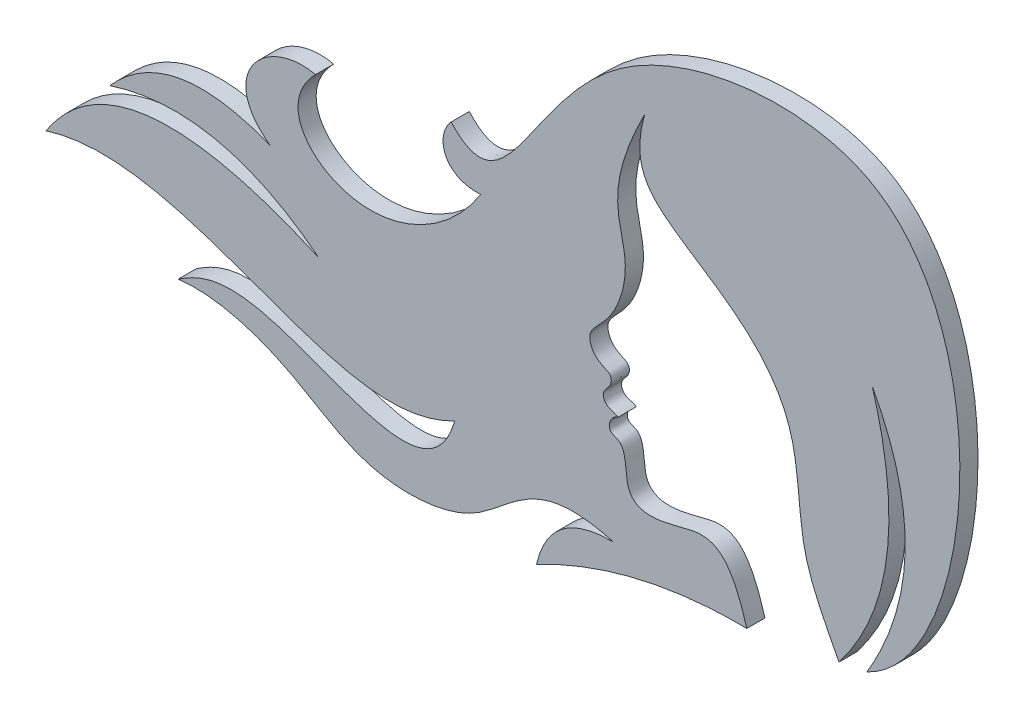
SolidWorks part; units mm, degrees
ref_plane "Front Plane" through (0, 0, 0) normal (0, 0, 1) x (1, 0, 0)
ref_plane "Top Plane" through (0, 0, 0) normal (0, 1, 0) x (1, 0, 0)
ref_plane "Right Plane" through (0, 0, 0) normal (1, 0, 0) x (0, 0, -1)
sketch "Picture" plane through (0, 0, 0) normal (0, 0, 1) x (1, 0, 0)
  line L0 (-354.2886, -45.4411) -> (145.7114, -45.4411) construction
  dimension "D1" = 500
sketch "Sketch2" plane through (0, 0, 0) normal (0, 0, 1) x (1, 0, 0)
  line L0 (96.8816, -76.9583) -> (137.5903, -8.7688) construction
  line L1 (137.5903, -8.7688) -> (99.8352, 60.9264) construction
  line L2 (99.8352, 60.9264) -> (124.9707, -23.8423) construction
  line L3 (124.9707, -23.8423) -> (81.5188, -79.936) construction
  line L4 (30.7604, -89.2686) -> (-31.0567, -88.3468) construction
  line L5 (-31.0567, -88.3468) -> (-85.0738, -116.5689) construction
  line L6 (-320.1333, -5.7193) -> (-260.5321, 13.5315) construction
  line L7 (-260.5321, 13.5315) -> (-204.8855, -30.3888) construction
  line L8 (-204.8855, -30.3888) -> (-314.2112, 18.7263) construction
  line L9 (-314.2112, 18.7263) -> (-355.3095, -44.8919) construction
  line L10 (-355.3095, -44.8919) -> (-281.1116, -21.0649) construction
  line L11 (-281.1116, -21.0649) -> (-207.5549, -89.7678) construction
  line L12 (-162.8538, -87.278) -> (-130.1269, -70.7791) construction
  line L13 (-130.1269, -70.7791) -> (-149.0629, -135.8716) construction
  line L14 (-149.0629, -135.8716) -> (-228.8308, -51.3697) construction
  line L15 (-259.7193, -64.239) -> (-282.5077, -79.2554) construction
  line L16 (-228.8308, -51.3697) -> (-259.7193, -64.239) construction
  line L17 (-207.5549, -89.7678) -> (-162.8538, -87.278) construction
  line L20 (-42.6455, -84.7637) -> (-77.616, -84.5109) construction
  line L21 (-77.616, -84.5109) -> (-85.0738, -116.5689) construction
  spline S0 degree 3 poles (96.8816, -76.9583) (151.2499, -51.4561) (169.9493, 100.0005) (76.3463, 179.4746) (-80.7116, 161.4531) (-100.7165, 37.137) (-132.1486, 70.8985) knots 0 0 0 0 0.421722 0.472248 0.700633 1 1 1 1
  spline S1 degree 3 poles (-132.1486, 70.8985) (-141.7006, 60.3257) (-135.7511, 42.9582) (-115.7913, 44.5519) knots 0 0 0 0 1 1 1 1
  spline S2 degree 3 poles (-115.7913, 44.5519) (-135.4395, 13.6686) (-193.3562, -8.7409) (-227.7464, 34.9026) (-206.8201, 56.1613) knots 0 0 0 0 0.521454 1 1 1 1
  spline S3 degree 3 poles (-206.8201, 56.1613) (-234.2464, 62.3302) (-262.8138, 32.2946) (-231.6716, 9.8032) knots 0 0 0 0 1 1 1 1
  spline S4 degree 2 poles (-231.6716, 9.8032) (-286.8531, 31.9452) (-320.1333, -5.7193) knots 0 0 0 1 1 1
  spline S5 degree 3 poles (-25.5912, 127.69) (-50.6896, 78.3833) (-29.051, 64.9818) (-41.061, 22.3908) (-56.7557, 9.6298) (-53.6486, -4.2986) (-44.0456, -3.2543) (-43.6916, -11.9856) (-49.3117, -14.8486) (-46.8278, -22.8113) (-43.259, -22.1214) (-40.0407, -23.8379) knots 0 0 0 0 0.134508 0.202578 0.22841 0.238908 0.299932 0.313731 0.363096 0.376392 0.440521 0.440521 0.440521 0.440521
  spline S6 degree 3 poles (-40.0407, -23.8379) (-44.0761, -25.0412) (-46.9785, -33.3839) (-34.8514, -34.6017) (-38.4069, -65.1344) (-1.9862, -60.3796) (19.4297, -49.6693) (30.7604, -89.2686) knots 0 0 0 0 0.068246 0.122923 0.276509 0.562112 1 1 1 1
  spline S7 degree 2 poles (96.8816, -76.9583) (137.5903, -8.7688) (99.8352, 60.9264) knots 0 0 0 1 1 1
  spline S8 degree 2 poles (99.8352, 60.9264) (124.9707, -23.8423) (81.5188, -79.936) knots 0 0 0 1 1 1
  spline S9 degree 2 poles (30.7604, -89.2686) (-31.0567, -88.3468) (-85.0738, -116.5689) knots 0 0 0 1 1 1
  spline S10 degree 2 poles (-320.1333, -5.7193) (-260.5321, 13.5315) (-204.8855, -30.3888) knots 0 0 0 1 1 1
  spline S11 degree 2 poles (-204.8855, -30.3888) (-314.2112, 18.7263) (-355.3095, -44.8919) knots 0 0 0 1 1 1
  spline S12 degree 3 poles (81.5188, -79.936) (70.1066, -58.0197) (59.5159, -37.7395) (58.7174, 45.5659) (-11.0596, 75.3073) (-32.6041, 102.8069) (-25.5912, 127.69) knots 0 0 0 0 0.197258 0.35261 0.761216 1 1 1 1
  spline S13 degree 4 poles (-355.3095, -44.8919) (-281.1116, -21.0649) (-207.5549, -89.7678) (-162.8538, -87.278) (-130.1269, -70.7791) knots 0 0 0 0 0 1 1 1 1 1
  spline S14 degree 4 poles (-130.1269, -70.7791) (-149.0629, -135.8716) (-228.8308, -51.3697) (-259.7193, -64.239) (-282.5077, -79.2554) knots 0 0 0 0 0 1 1 1 1 1
  spline S15 degree 3 poles (-282.5077, -79.2554) (-269.859, -77.568) (-220.2468, -85.7672) (-188.9402, -121.4973) (-104.9409, -116.7474) (-89.0038, -71.6678) (-42.6455, -84.7637) knots 0 0 0 0 0.112722 0.42883 0.64991 1 1 1 1
  spline S16 degree 2 poles (-42.6455, -84.7637) (-77.616, -84.5109) (-85.0738, -116.5689) knots 0 0 0 1 1 1
extrude "Boss-Extrude1" add sketch "Sketch2" along normal blind 10
